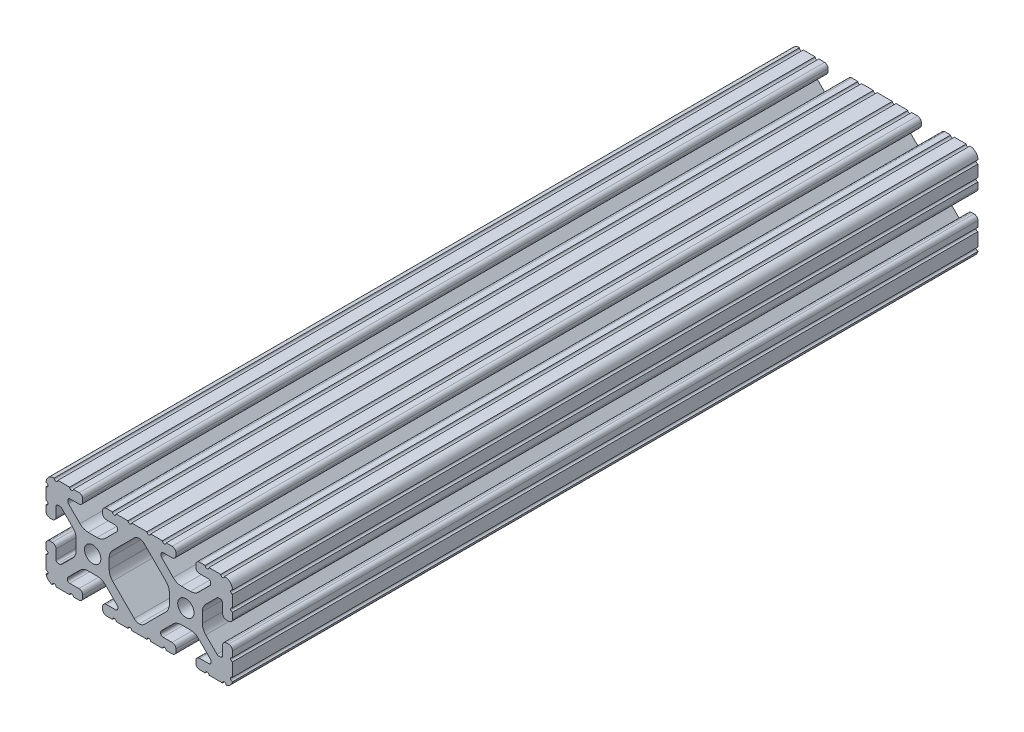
SolidWorks part; units mm, degrees
ref_plane "Front Plane" through (0, 0, 0) normal (0, 0, 1) x (1, 0, 0)
ref_plane "Top Plane" through (0, 0, 0) normal (0, 1, 0) x (1, 0, 0)
ref_plane "Right Plane" through (0, 0, 0) normal (1, 0, 0) x (0, 0, -1)
sketch "Sketch1" plane through (0, 0, 0) normal (0, 0, 1) x (1, 0, 0)
  line L0 (-3.1211, -19.05) -> (3.1211, -19.05)
  line L1 (-38.1, 10.287) -> (-38.1, 14.3752)
  line L2 (0, -34.5561) -> (0, 32.8014) construction
  line L3 (-38.1, 0) -> (0, 0) construction
  line L4 (-38.1, 9.5497) -> (-38.1, 10.287)
  line L5 (-19.05, 19.05) -> (-19.05, -20.2827) construction
  line L6 (0, -15.1247) -> (0, -15.1131) construction
  line L7 (9.1761, 12.9058) -> (13.8525, 8.2294)
  line L8 (8.9158, 14.097) -> (8.9158, 13.5344)
  line L9 (13.4112, 14.986) -> (9.8048, 14.986)
  line L10 (14.986, 17.4968) -> (14.986, 16.5608)
  line L11 (10.9975, 19.05) -> (13.4328, 19.05)
  line L12 (8.6331, 19.05) -> (9.4735, 19.05)
  line L13 (4.6451, 19.05) -> (8.6331, 19.05)
  line L14 (31.792, 10.0266) -> (27.1976, 5.4321)
  line L15 (33.147, 10.287) -> (32.4207, 10.287)
  line L16 (29.2071, 19.05) -> (33.2963, 19.05)
  line L17 (28.4698, 19.05) -> (29.2071, 19.05)
  line L18 (-38.1, 5.6388) -> (-38.1, 8.0257)
  line L19 (24.5589, 19.05) -> (26.9458, 19.05)
  line L20 (23.114, 16.5608) -> (23.114, 17.4806)
  line L21 (28.2952, 14.986) -> (24.6888, 14.986)
  line L22 (29.1842, 13.5344) -> (29.1842, 14.097)
  line L23 (-34.036, 9.398) -> (-34.036, 5.6388)
  line L24 (-35.6108, 4.064) -> (-36.5252, 4.064)
  line L25 (24.2475, 8.2294) -> (28.9239, 12.9058)
  line L26 (25.8064, -2.0735) -> (25.8064, 2.0735)
  line L27 (35.6108, 4.064) -> (36.5252, 4.064)
  line L28 (34.036, 9.398) -> (34.036, 5.6388)
  line L29 (38.1, 5.6388) -> (38.1, 8.0257)
  line L30 (38.1, 9.5497) -> (38.1, 10.287)
  line L31 (38.1, 10.287) -> (38.1, 14.3752)
  line L32 (17.2111, 6.8382) -> (20.8889, 6.8382)
  line L33 (2.077, 14.2576) -> (10.9024, 5.4321)
  line L34 (-31.792, -10.0266) -> (-27.1976, -5.4321)
  line L35 (-33.147, -10.287) -> (-32.4207, -10.287)
  line L36 (-29.2071, -19.05) -> (-34.0473, -19.05)
  line L37 (-28.4698, -19.05) -> (-29.2071, -19.05)
  line L38 (-24.6888, -19.05) -> (-26.9458, -19.05)
  line L39 (12.2936, -2.0735) -> (12.2936, 2.0735)
  line L40 (-23.114, -16.5608) -> (-23.114, -17.4752)
  line L41 (-28.448, -14.986) -> (-24.6888, -14.986)
  line L42 (-29.337, -13.6872) -> (-29.337, -14.097)
  line L43 (2.077, -14.2576) -> (10.9024, -5.4321)
  line L44 (-3.1211, 19.05) -> (3.1211, 19.05)
  line L45 (8.763, -14.097) -> (8.763, -13.6872)
  line L46 (-24.2475, -8.2294) -> (-29.0766, -13.0586)
  line L47 (-35.6108, -4.064) -> (-36.5252, -4.064)
  line L48 (-34.036, -9.398) -> (-34.036, -5.6388)
  line L49 (-38.1, -5.6388) -> (-38.1, -8.0257)
  line L50 (-38.1, -9.5497) -> (-38.1, -10.287)
  line L51 (-38.1, -10.287) -> (-38.1, -15.036)
  line L52 (17.2111, -6.8382) -> (20.8889, -6.8382)
  line L53 (38.1, -10.287) -> (38.1, -15.036)
  line L54 (38.1, -9.5497) -> (38.1, -10.287)
  line L55 (38.1, -5.6388) -> (38.1, -8.0257)
  line L56 (34.036, -9.398) -> (34.036, -5.6388)
  line L57 (35.6108, -4.064) -> (36.5252, -4.064)
  line L58 (24.2475, -8.2294) -> (29.0766, -13.0586)
  line L59 (29.337, -13.6872) -> (29.337, -14.097)
  line L60 (-17.2111, -6.8382) -> (-20.8889, -6.8382)
  line L61 (-9.0234, -13.0586) -> (-13.8525, -8.2294)
  line L62 (-8.763, -14.097) -> (-8.763, -13.6872)
  line L63 (-13.4112, -14.986) -> (-9.652, -14.986)
  line L64 (-14.986, -17.4752) -> (-14.986, -16.5608)
  line L65 (-10.9975, -19.05) -> (-13.4112, -19.05)
  line L66 (28.448, -14.986) -> (24.6888, -14.986)
  line L67 (23.114, -16.5608) -> (23.114, -17.4752)
  line L68 (24.6888, -19.05) -> (26.9458, -19.05)
  line L69 (28.4698, -19.05) -> (29.2071, -19.05)
  line L70 (29.2071, -19.05) -> (34.0473, -19.05)
  line L71 (-8.6331, -19.05) -> (-9.4735, -19.05)
  line L72 (33.147, -10.287) -> (32.4207, -10.287)
  line L73 (31.792, -10.0266) -> (27.1976, -5.4321)
  line L74 (-4.6451, -19.05) -> (-8.6331, -19.05)
  line L75 (9.0234, -13.0586) -> (13.8525, -8.2294)
  line L76 (13.4112, -14.986) -> (9.652, -14.986)
  line L77 (-2.077, -14.2576) -> (-10.9024, -5.4321)
  line L78 (14.986, -17.4752) -> (14.986, -16.5608)
  line L79 (10.9975, -19.05) -> (13.4112, -19.05)
  line L80 (4.6451, -19.05) -> (8.6331, -19.05)
  line L81 (8.6331, -19.05) -> (9.4735, -19.05)
  line L83 (-12.2936, -2.0735) -> (-12.2936, 2.0735)
  line L84 (-25.8064, -2.0735) -> (-25.8064, 2.0735)
  line L85 (-2.077, 14.2576) -> (-10.9024, 5.4321)
  line L87 (-4.6451, 19.05) -> (-8.6331, 19.05)
  line L88 (-8.6331, 19.05) -> (-9.4735, 19.05)
  line L89 (-10.9975, 19.05) -> (-13.4328, 19.05)
  line L90 (-14.986, 17.4968) -> (-14.986, 16.5608)
  line L91 (-13.4112, 14.986) -> (-9.8048, 14.986)
  line L92 (-8.9158, 14.097) -> (-8.9158, 13.5344)
  line L93 (-9.1761, 12.9058) -> (-13.8525, 8.2294)
  line L94 (-17.2111, 6.8382) -> (-20.8889, 6.8382)
  line L95 (-24.2475, 8.2294) -> (-28.9239, 12.9058)
  line L96 (-29.1842, 13.5344) -> (-29.1842, 14.097)
  line L97 (-28.2952, 14.986) -> (-24.6888, 14.986)
  line L98 (-23.114, 16.5608) -> (-23.114, 17.4806)
  line L99 (-24.5589, 19.05) -> (-26.9458, 19.05)
  line L100 (-28.4698, 19.05) -> (-29.2071, 19.05)
  line L101 (-29.2071, 19.05) -> (-33.2963, 19.05)
  line L109 (-33.147, 10.287) -> (-32.4207, 10.287)
  line L165 (-31.792, 10.0266) -> (-27.1976, 5.4321)
  arc A0 (-38.1376, 15.8983) -> (-38.1, 14.3752) centre (-38.1, 15.1372) cw
  arc A1 (-38.1, 9.5497) -> (-38.1, 8.0257) centre (-38.1, 8.7877) cw
  arc A2 (9.1761, 12.9058) -> (8.9158, 13.5344) centre (9.8048, 13.5344) cw
  arc A3 (8.9158, 14.097) -> (9.8048, 14.986) centre (9.8048, 14.097) cw
  arc A4 (-36.5252, 4.064) -> (-38.1, 5.6388) centre (-36.5252, 5.6388) cw
  arc A5 (14.986, 16.5608) -> (13.4112, 14.986) centre (13.4112, 16.5608) cw
  arc A6 (13.4328, 19.05) -> (14.986, 17.4968) centre (13.4328, 17.4968) cw
  arc A7 (10.9975, 19.05) -> (9.4735, 19.05) centre (10.2355, 19.05) cw
  arc A8 (4.6451, 19.05) -> (3.1211, 19.05) centre (3.8831, 19.05) cw
  arc A9 (0, 15.1131) -> (2.077, 14.2576) centre (0.0116, 12.1921) cw
  arc A10 (25.8064, 2.0735) -> (27.1976, 5.4321) centre (30.5562, 2.0735) cw
  arc A11 (31.792, 10.0266) -> (32.4207, 10.287) centre (32.4207, 9.398) cw
  arc A12 (33.147, 10.287) -> (34.036, 9.398) centre (33.147, 9.398) cw
  arc A13 (34.8195, 19.0968) -> (38.1376, 15.8983) centre (34.903, 15.8631) cw
  arc A14 (34.8195, 19.0968) -> (33.2963, 19.05) centre (34.0579, 19.0734) cw
  arc A15 (28.4698, 19.05) -> (26.9458, 19.05) centre (27.7078, 19.05) cw
  arc A16 (23.114, 17.4806) -> (24.5589, 19.05) centre (24.6888, 17.4806) cw
  arc A17 (24.6888, 14.986) -> (23.114, 16.5608) centre (24.6888, 16.5608) cw
  arc A18 (28.2952, 14.986) -> (29.1842, 14.097) centre (28.2952, 14.097) cw
  arc A19 (29.1842, 13.5344) -> (28.9239, 12.9058) centre (28.2952, 13.5344) cw
  arc A20 (-35.5713, -19.05) -> (-38.1, -16.56) centre (-34.9455, -15.8855) cw
  arc A21 (34.036, 5.6388) -> (35.6108, 4.064) centre (35.6108, 5.6388) ccw
  arc A22 (36.5252, 4.064) -> (38.1, 5.6388) centre (36.5252, 5.6388) ccw
  arc A23 (38.1, 9.5497) -> (38.1, 8.0257) centre (38.1, 8.7877) ccw
  arc A24 (24.2475, 8.2294) -> (20.8889, 6.8382) centre (20.8889, 11.588) cw
  arc A25 (17.2111, 6.8382) -> (13.8525, 8.2294) centre (17.2111, 11.588) cw
  arc A26 (10.9024, 5.4321) -> (12.2936, 2.0735) centre (7.5438, 2.0735) cw
  arc A27 (0, -15.1131) -> (2.077, -14.2576) centre (0.0116, -12.1921) ccw
  arc A28 (-34.036, 5.6388) -> (-35.6108, 4.064) centre (-35.6108, 5.6388) cw
  arc A29 (-25.8064, -2.0735) -> (-27.1976, -5.4321) centre (-30.5562, -2.0735) cw
  arc A30 (-31.792, -10.0266) -> (-32.4207, -10.287) centre (-32.4207, -9.398) cw
  arc A31 (-33.147, -10.287) -> (-34.036, -9.398) centre (-33.147, -9.398) cw
  arc A33 (-35.5713, -19.05) -> (-34.0473, -19.05) centre (-34.8093, -19.05) cw
  arc A34 (-28.4698, -19.05) -> (-26.9458, -19.05) centre (-27.7078, -19.05) cw
  arc A35 (10.9024, -5.4321) -> (12.2936, -2.0735) centre (7.5438, -2.0735) ccw
  circle A36 centre (19.05, 0) radius 3.3274
  arc A37 (-23.114, -17.4752) -> (-24.6888, -19.05) centre (-24.6888, -17.4752) cw
  arc A38 (-24.6888, -14.986) -> (-23.114, -16.5608) centre (-24.6888, -16.5608) cw
  arc A39 (-28.448, -14.986) -> (-29.337, -14.097) centre (-28.448, -14.097) cw
  arc A40 (-29.337, -13.6872) -> (-29.0766, -13.0586) centre (-28.448, -13.6872) cw
  arc A41 (-24.2475, -8.2294) -> (-20.8889, -6.8382) centre (-20.8889, -11.588) cw
  arc A42 (-34.036, -5.6388) -> (-35.6108, -4.064) centre (-35.6108, -5.6388) ccw
  arc A43 (-36.5252, -4.064) -> (-38.1, -5.6388) centre (-36.5252, -5.6388) ccw
  arc A44 (-38.1, -9.5497) -> (-38.1, -8.0257) centre (-38.1, -8.7877) ccw
  arc A45 (-38.1, -16.56) -> (-38.1, -15.036) centre (-38.1, -15.798) ccw
  arc A46 (38.1, -16.56) -> (38.1, -15.036) centre (38.1, -15.798) cw
  arc A47 (38.1, -9.5497) -> (38.1, -8.0257) centre (38.1, -8.7877) cw
  arc A48 (36.5252, -4.064) -> (38.1, -5.6388) centre (36.5252, -5.6388) cw
  arc A49 (34.036, -5.6388) -> (35.6108, -4.064) centre (35.6108, -5.6388) cw
  arc A50 (24.2475, -8.2294) -> (20.8889, -6.8382) centre (20.8889, -11.588) ccw
  arc A51 (29.337, -13.6872) -> (29.0766, -13.0586) centre (28.448, -13.6872) ccw
  arc A52 (28.448, -14.986) -> (29.337, -14.097) centre (28.448, -14.097) ccw
  arc A53 (24.6888, -14.986) -> (23.114, -16.5608) centre (24.6888, -16.5608) ccw
  arc A54 (-17.2111, -6.8382) -> (-13.8525, -8.2294) centre (-17.2111, -11.588) cw
  arc A55 (-9.0234, -13.0586) -> (-8.763, -13.6872) centre (-9.652, -13.6872) cw
  arc A56 (-8.763, -14.097) -> (-9.652, -14.986) centre (-9.652, -14.097) cw
  arc A57 (-14.986, -16.5608) -> (-13.4112, -14.986) centre (-13.4112, -16.5608) cw
  arc A58 (-13.4112, -19.05) -> (-14.986, -17.4752) centre (-13.4112, -17.4752) cw
  arc A59 (-10.9975, -19.05) -> (-9.4735, -19.05) centre (-10.2355, -19.05) cw
  arc A60 (-4.6451, -19.05) -> (-3.1211, -19.05) centre (-3.8831, -19.05) cw
  arc A61 (23.114, -17.4752) -> (24.6888, -19.05) centre (24.6888, -17.4752) ccw
  arc A62 (28.4698, -19.05) -> (26.9458, -19.05) centre (27.7078, -19.05) ccw
  arc A63 (35.5713, -19.05) -> (34.0473, -19.05) centre (34.8093, -19.05) ccw
  arc A64 (35.5713, -19.05) -> (38.1, -16.56) centre (34.9379, -15.8778) ccw
  arc A65 (33.147, -10.287) -> (34.036, -9.398) centre (33.147, -9.398) ccw
  arc A66 (31.792, -10.0266) -> (32.4207, -10.287) centre (32.4207, -9.398) ccw
  arc A67 (-10.9024, -5.4321) -> (-12.2936, -2.0735) centre (-7.5438, -2.0735) cw
  arc A68 (0, -15.1131) -> (-2.077, -14.2576) centre (-0.0116, -12.1921) cw
  arc A69 (0, 15.1131) -> (-2.077, 14.2576) centre (-0.0116, 12.1921) ccw
  arc A70 (-10.9024, 5.4321) -> (-12.2936, 2.0735) centre (-7.5438, 2.0735) ccw
  arc A71 (25.8064, -2.0735) -> (27.1976, -5.4321) centre (30.5562, -2.0735) ccw
  arc A72 (9.0234, -13.0586) -> (8.763, -13.6872) centre (9.652, -13.6872) ccw
  arc A73 (8.763, -14.097) -> (9.652, -14.986) centre (9.652, -14.097) ccw
  arc A74 (17.2111, -6.8382) -> (13.8525, -8.2294) centre (17.2111, -11.588) ccw
  arc A75 (13.4112, -19.05) -> (14.986, -17.4752) centre (13.4112, -17.4752) ccw
  arc A76 (14.986, -16.5608) -> (13.4112, -14.986) centre (13.4112, -16.5608) ccw
  arc A77 (-4.6451, 19.05) -> (-3.1211, 19.05) centre (-3.8831, 19.05) ccw
  arc A78 (-10.9975, 19.05) -> (-9.4735, 19.05) centre (-10.2355, 19.05) ccw
  arc A79 (-13.4328, 19.05) -> (-14.986, 17.4968) centre (-13.4328, 17.4968) ccw
  arc A80 (-14.986, 16.5608) -> (-13.4112, 14.986) centre (-13.4112, 16.5608) ccw
  arc A81 (-8.9158, 14.097) -> (-9.8048, 14.986) centre (-9.8048, 14.097) ccw
  arc A82 (-9.1761, 12.9058) -> (-8.9158, 13.5344) centre (-9.8048, 13.5344) ccw
  arc A83 (-17.2111, 6.8382) -> (-13.8525, 8.2294) centre (-17.2111, 11.588) ccw
  arc A84 (-24.2475, 8.2294) -> (-20.8889, 6.8382) centre (-20.8889, 11.588) ccw
  arc A85 (-29.1842, 13.5344) -> (-28.9239, 12.9058) centre (-28.2952, 13.5344) ccw
  arc A86 (-28.2952, 14.986) -> (-29.1842, 14.097) centre (-28.2952, 14.097) ccw
  arc A87 (-24.6888, 14.986) -> (-23.114, 16.5608) centre (-24.6888, 16.5608) ccw
  arc A88 (-23.114, 17.4806) -> (-24.5589, 19.05) centre (-24.6888, 17.4806) ccw
  arc A89 (-28.4698, 19.05) -> (-26.9458, 19.05) centre (-27.7078, 19.05) ccw
  arc A90 (-34.8195, 19.0968) -> (-33.2963, 19.05) centre (-34.0579, 19.0734) ccw
  arc A91 (-34.8195, 19.0968) -> (-38.1376, 15.8983) centre (-34.903, 15.8631) ccw
  arc A92 (4.6451, -19.05) -> (3.1211, -19.05) centre (3.8831, -19.05) ccw
  arc A93 (10.9975, -19.05) -> (9.4735, -19.05) centre (10.2355, -19.05) ccw
  arc A94 (38.1376, 15.8983) -> (38.1, 14.3752) centre (38.1, 15.1372) ccw
  arc A96 (-33.147, 10.287) -> (-34.036, 9.398) centre (-33.147, 9.398) ccw
  arc A97 (-31.792, 10.0266) -> (-32.4207, 10.287) centre (-32.4207, 9.398) ccw
  arc A98 (-25.8064, 2.0735) -> (-27.1976, 5.4321) centre (-30.5562, 2.0735) ccw
  circle A101 centre (-19.05, 0) radius 3.3274
  point P34 (0, 19.05)
  point P79 (25.6765, 0)
  point P274 (0, -19.05)
  point P282 (-25.6765, 0)
  point P283 (-12.2936, 0)
  dimension "D1" = 38.1
  dimension "D4" = 6.6548
  dimension "D10" = 4.064
  dimension "D2" = 76.2
  dimension "D3" = 38.1
  dimension "D5" = 8.128
  dimension "D6" = 20.574
  dimension "D7" = 12.2936
  dimension "D8" = 4.064
  dimension "D9" = 4.064
extrude "Extrude1" add sketch "Sketch1" against normal blind 304.8
